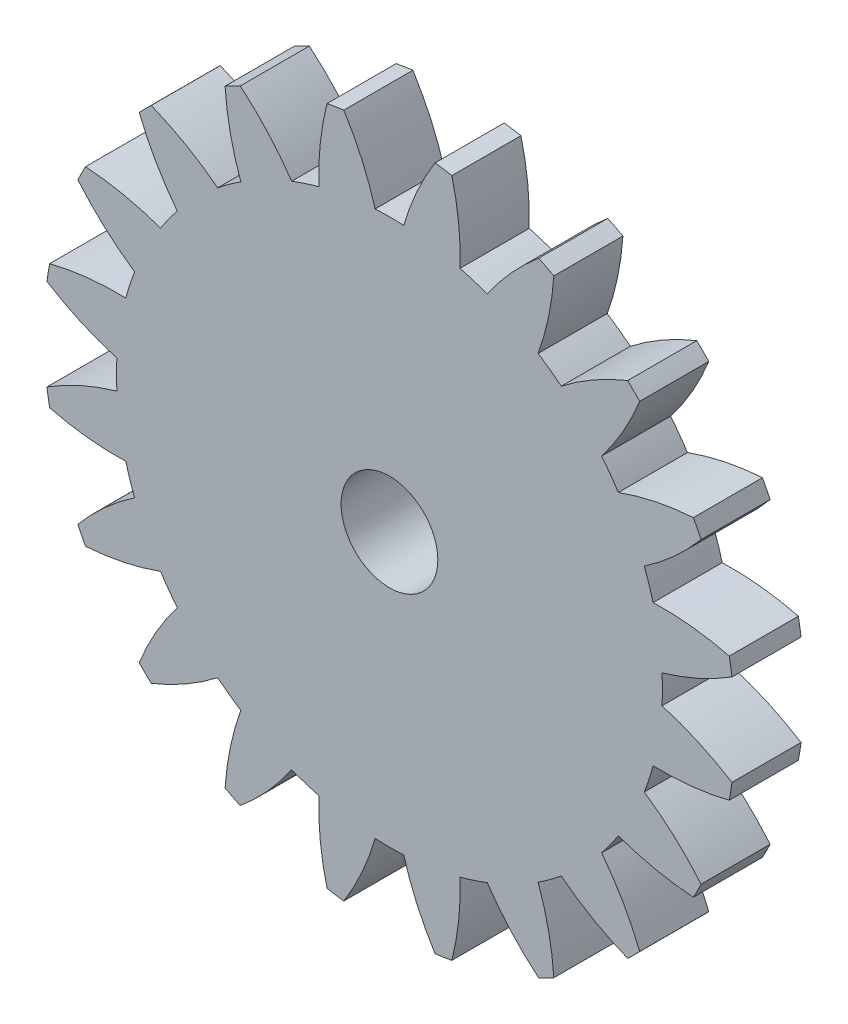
SolidWorks part; units mm, degrees
ref_plane "前基準面" through (0, 0, 0) normal (0, 0, 1) x (1, 0, 0)
ref_plane "上基準面" through (0, 0, 0) normal (0, 1, 0) x (1, 0, 0)
ref_plane "右基準面" through (0, 0, 0) normal (1, 0, 0) x (0, 0, -1)
sketch "草圖1" plane through (0, 0, 0) normal (0, 0, 1) x (1, 0, 0)
  line L0 (0, -15.5) -> (-7.8217, 33.8844) construction
  line L1 (0, -15.5) -> (7.8217, 33.8844) construction
  line L2 (0, -15.5) -> (0, 34.5) construction
  line L3 (0, -15.5) -> (-2.0673, 23.9459) construction
  line L4 (0, -15.5) -> (2.0673, 23.9459) construction
  line L5 (0, 47.5) -> (-6.8883, 30.8702) construction
  line L7 (0, 47.5) -> (6.8883, 30.8702) construction
  line L8 (0, 47.5) -> (-3.4455, 35.4842) construction
  line L9 (0, 47.5) -> (3.4455, 35.4842) construction
  line L10 (-1.625, 24.5) -> (1.625, 24.5)
  circle A0 centre (0, -15.5) radius 39.5
  circle A1 centre (0, -15.5) radius 45 construction
  arc A2 (-21.5968, 29.5952) -> (-23.7885, 28.4785) centre (0, -15.5) ccw
  circle A3 centre (0, -15.5) radius 7
  arc A4 (-6.6046, 34.0619) -> (-2.0673, 23.9459) centre (-40.3648, 12.8439) cw
  arc A5 (6.6046, 34.0619) -> (2.0673, 23.9459) centre (40.3648, 12.8439) ccw
  circle A6 centre (0, 47.5) radius 5
  circle A7 centre (0, 47.5) radius 12.5
  circle A8 centre (0, 47.5) radius 18 construction
  arc A9 (-3.4455, 35.4842) -> (-1.625, 24.5) centre (29.8672, 35.3623) ccw
  arc A10 (3.4455, 35.4842) -> (1.625, 24.5) centre (-29.8672, 35.3623) cw
  arc A11 (-21.5968, 29.5952) -> (-14.1555, 21.3764) centre (-47.1479, -1.0167) cw
  arc A12 (-9.0341, 33.6771) -> (-10.2234, 22.6541) centre (29.6304, 23.93) ccw
  arc A13 (-34.475, 20.7143) -> (-24.8582, 15.1973) centre (-49.3159, -16.2951) cw
  arc A14 (-23.7885, 28.4785) -> (-21.5132, 17.6275) centre (15.9956, 31.1565) ccw
  arc A15 (-43.9785, 8.2885) -> (-33.1275, 6.0132) centre (-46.6565, -31.4956) cw
  arc A16 (-36.2143, 18.975) -> (-30.6973, 9.3582) centre (0.7951, 33.8159) ccw
  arc A17 (-49.1771, -6.4659) -> (-38.1541, -5.2766) centre (-39.43, -45.1304) cw
  arc A18 (-45.0952, 6.0968) -> (-36.8764, -1.3445) centre (-14.4833, 31.6479) ccw
  arc A19 (-49.5619, -22.1046) -> (-39.4459, -17.5673) centre (-28.3439, -55.8648) cw
  arc A20 (-49.5619, -8.8954) -> (-39.4459, -13.4327) centre (-28.3439, 24.8648) ccw
  arc A21 (-45.0952, -37.0968) -> (-36.8764, -29.6555) centre (-14.4833, -62.6479) cw
  arc A22 (-49.1771, -24.5341) -> (-38.1541, -25.7234) centre (-39.43, 14.1304) ccw
  arc A23 (-36.2143, -49.975) -> (-30.6973, -40.3582) centre (0.7951, -64.8159) cw
  arc A24 (-43.9785, -39.2885) -> (-33.1275, -37.0132) centre (-46.6565, 0.4956) ccw
  arc A25 (-23.7885, -59.4785) -> (-21.5132, -48.6275) centre (15.9956, -62.1565) cw
  arc A26 (-34.475, -51.7143) -> (-24.8582, -46.1973) centre (-49.3159, -14.7049) ccw
  arc A27 (-9.0341, -64.6771) -> (-10.2234, -53.6541) centre (29.6304, -54.93) cw
  arc A28 (-21.5968, -60.5952) -> (-14.1555, -52.3764) centre (-47.1479, -29.9833) ccw
  arc A29 (6.6046, -65.0619) -> (2.0673, -54.9459) centre (40.3648, -43.8439) cw
  arc A30 (-6.6046, -65.0619) -> (-2.0673, -54.9459) centre (-40.3648, -43.8439) ccw
  arc A31 (21.5968, -60.5952) -> (14.1555, -52.3764) centre (47.1479, -29.9833) cw
  arc A32 (9.0341, -64.6771) -> (10.2234, -53.6541) centre (-29.6304, -54.93) ccw
  arc A33 (34.475, -51.7143) -> (24.8582, -46.1973) centre (49.3159, -14.7049) cw
  arc A34 (23.7885, -59.4785) -> (21.5132, -48.6275) centre (-15.9956, -62.1565) ccw
  arc A35 (43.9785, -39.2885) -> (33.1275, -37.0132) centre (46.6565, 0.4956) cw
  arc A36 (36.2143, -49.975) -> (30.6973, -40.3582) centre (-0.7951, -64.8159) ccw
  arc A37 (49.1771, -24.5341) -> (38.1541, -25.7234) centre (39.43, 14.1304) cw
  arc A38 (45.0952, -37.0968) -> (36.8764, -29.6555) centre (14.4833, -62.6479) ccw
  arc A39 (49.5619, -8.8954) -> (39.4459, -13.4327) centre (28.3439, 24.8648) cw
  arc A40 (49.5619, -22.1046) -> (39.4459, -17.5673) centre (28.3439, -55.8648) ccw
  arc A41 (45.0952, 6.0968) -> (36.8764, -1.3445) centre (14.4833, 31.6479) cw
  arc A42 (49.1771, -6.4659) -> (38.1541, -5.2766) centre (39.43, -45.1304) ccw
  arc A43 (36.2143, 18.975) -> (30.6973, 9.3582) centre (-0.7951, 33.8159) cw
  arc A44 (43.9785, 8.2885) -> (33.1275, 6.0132) centre (46.6565, -31.4956) ccw
  arc A45 (23.7885, 28.4785) -> (21.5132, 17.6275) centre (-15.9956, 31.1565) cw
  arc A46 (34.475, 20.7143) -> (24.8582, 15.1973) centre (49.3159, -16.2951) ccw
  arc A47 (9.0341, 33.6771) -> (10.2234, 22.6541) centre (-29.6304, 23.93) cw
  arc A48 (21.5968, 29.5952) -> (14.1555, 21.3764) centre (47.1479, -1.0167) ccw
  arc A49 (-6.6046, 34.0619) -> (-9.0341, 33.6771) centre (0, -15.5) ccw
  arc A50 (9.0341, 33.6771) -> (6.6046, 34.0619) centre (0, -15.5) ccw
  arc A51 (23.7885, 28.4785) -> (21.5968, 29.5952) centre (0, -15.5) ccw
  arc A52 (36.2143, 18.975) -> (34.475, 20.7143) centre (0, -15.5) ccw
  arc A53 (45.0952, 6.0968) -> (43.9785, 8.2885) centre (0, -15.5) ccw
  arc A54 (49.5619, -8.8954) -> (49.1771, -6.4659) centre (0, -15.5) ccw
  arc A55 (49.1771, -24.5341) -> (49.5619, -22.1046) centre (0, -15.5) ccw
  arc A56 (43.9785, -39.2885) -> (45.0952, -37.0968) centre (0, -15.5) ccw
  arc A57 (34.475, -51.7143) -> (36.2143, -49.975) centre (0, -15.5) ccw
  arc A58 (21.5968, -60.5952) -> (23.7885, -59.4785) centre (0, -15.5) ccw
  arc A59 (6.6046, -65.0619) -> (9.0341, -64.6771) centre (0, -15.5) ccw
  arc A60 (-9.0341, -64.6771) -> (-6.6046, -65.0619) centre (0, -15.5) ccw
  arc A61 (-23.7885, -59.4785) -> (-21.5968, -60.5952) centre (0, -15.5) ccw
  arc A62 (-36.2143, -49.975) -> (-34.475, -51.7143) centre (0, -15.5) ccw
  arc A63 (-45.0952, -37.0968) -> (-43.9785, -39.2885) centre (0, -15.5) ccw
  arc A64 (-49.5619, -22.1046) -> (-49.1771, -24.5341) centre (0, -15.5) ccw
  arc A65 (-49.1771, -6.4659) -> (-49.5619, -8.8954) centre (0, -15.5) ccw
  arc A66 (-34.475, 20.7143) -> (-36.2143, 18.975) centre (0, -15.5) ccw
  arc A67 (-43.9785, 8.2885) -> (-45.0952, 6.0968) centre (0, -15.5) ccw
  point P18 (0, 24.5)
  point P144 (0, -15.5)
  dimension "D1" = 79
  dimension "D2" = 90
  dimension "D3" = 100
  dimension "D6" = 14
  dimension "D9" = 25
  dimension "D10" = 10
  dimension "D15" = 33.3129
  dimension "D16" = 39.8742
  dimension "D4" = 18
  dimension "D5" = 6
  dimension "D7" = 1.23
  dimension "D8" = 63
  dimension "D11" = 45
  dimension "D12" = 32
  dimension "D13" = 3.25
  dimension "D14" = 23
  dimension "D17" = 20
extrude "填料-伸長1" add sketch "草圖1" along normal blind 10 contours A0 A3 | A13 A66 A16 A0 | A2 A14 A0 A11 | A4 A49 A12 A0 | A47 A50 A5 A0 | A45 A51 A48 A0 | A43 A52 A46 A0 | A41 A53 A44 A0 | A39 A54 A42 A0 | A37 A55 A40 A0 | A35 A56 A38 A0 | A33 A57 A36 A0 | A31 A58 A34 A0 | A29 A59 A32 A0 | A27 A60 A30 A0 | A25 A61 A28 A0 | A23 A62 A26 A0 | A21 A63 A24 A0 | A19 A64 A22 A0 | A17 A65 A20 A0 | A15 A67 A18 A0
